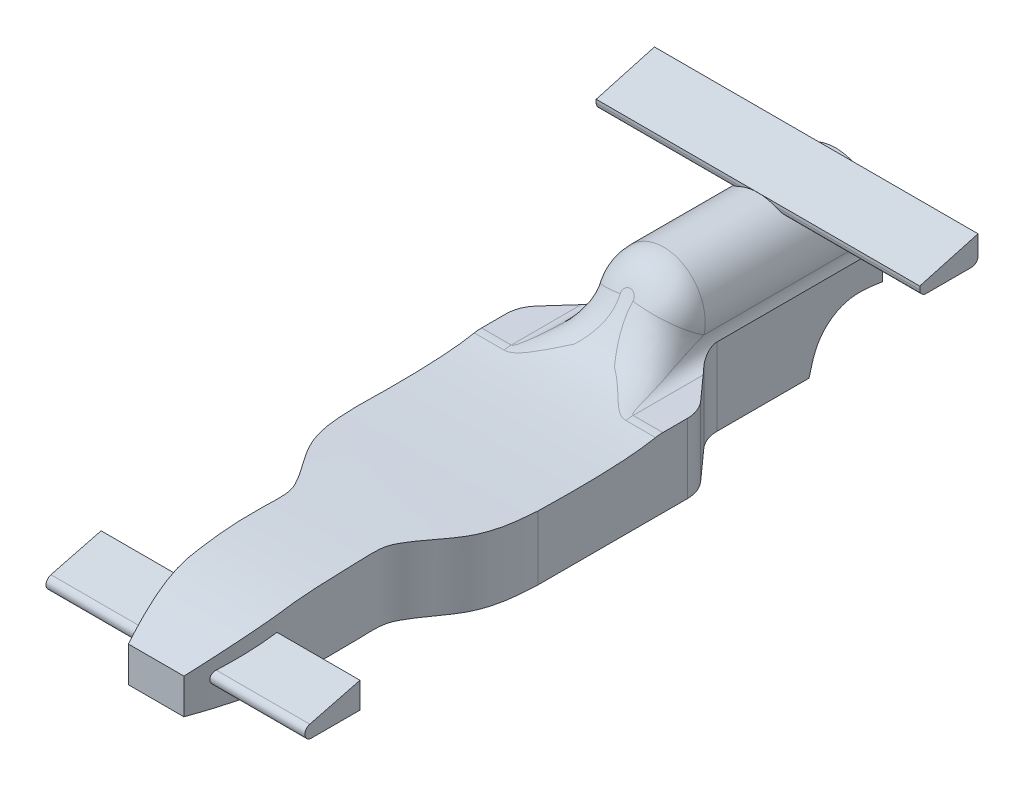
SolidWorks part; units mm, degrees
ref_plane "Front Plane" through (0, 0, 0) normal (0, 0, 1) x (1, 0, 0)
ref_plane "Top Plane" through (0, 0, 0) normal (0, 1, 0) x (1, 0, 0)
ref_plane "Right Plane" through (0, 0, 0) normal (1, 0, 0) x (0, 0, -1)
sketch "Sketch1" plane through (0, 0, 0) normal (0, 0, 1) x (1, 0, 0)
  line L1 (-32.5, 0) -> (32.5, 0)
  line L2 (-32.5, 0) -> (-32.5, 50)
  line L3 (-32.5, 50) -> (32.5, 50)
  line L4 (32.5, 0) -> (32.5, 50)
  dimension "D1" = 65
  dimension "D2" = 50
extrude "Balsa Block" add sketch "Sketch1" along normal blind 223
sketch "Sketch2" plane through (0, 0, 223) normal (0, 0, 1) x (1, 0, 0)
  line L0 (-32.5, 0) -> (32.5, 0) construction
  line L1 (-3, 0) -> (3, 0)
  line L2 (-3, 0) -> (-3, 6)
  line L3 (-3, 6) -> (3, 6)
  line L4 (3, 0) -> (3, 6)
  dimension "D1" = 6
  dimension "D2" = 6
extrude "Screw Eye Slot" [suppressed] cut sketch "Sketch2" against normal through all
sketch "Sketch3" plane through (0, 0, 0) normal (0, 0, -1) x (-1, 0, 0)
  line L0 (32.5, 0) -> (-32.5, 0) construction
  circle A0 centre (0, 29) radius 9.55
  dimension "D1" = 19.1
  dimension "D2" = 29
extrude "CO2 Cartridge Hole" cut sketch "Sketch3" against normal blind 52
sketch "Sketch5" plane through (0, 50, 0) normal (0, 1, 0) x (1, 0, 0)
  line L0 (32.5, 0) -> (-32.5, 0) construction
  line L1 (0, 0) -> (0, -229.7898) construction
  line L2 (-14.55, 0) -> (-14.55, -51.1732)
  line L3 (-17.1047, -57.8491) -> (-25.4453, -67.1509)
  line L4 (-28, -73.8268) -> (-28, -120)
  line L5 (-14.4879, 48.8908) -> (-14.4879, 49.7327) construction
  line L6 (28, -73.8268) -> (28, -120)
  line L7 (17.1047, -57.8491) -> (25.4453, -67.1509)
  line L8 (14.55, 0) -> (14.55, -51.1732)
  line L9 (-14.7766, 49.831) -> (-14.7766, 50.2789) construction
  line L10 (-9.55, 0) -> (-9.55, -52) construction
  line L11 (9.55, -52) -> (9.55, 0) construction
  arc A0 (-25.4453, -67.1509) -> (-28, -73.8268) centre (-18, -73.8268) ccw
  arc A1 (-14.55, -51.1732) -> (-17.1047, -57.8491) centre (-24.55, -51.1732) cw
  arc A2 (14.55, -51.1732) -> (17.1047, -57.8491) centre (24.55, -51.1732) ccw
  arc A3 (25.4453, -67.1509) -> (28, -73.8268) centre (18, -73.8268) cw
  spline S0 degree 3 poles (-28, -120) (-27.6859, -126.0056) (-27.1636, -135.9946) (-19.7034, -144.9636) (-13.3488, -154.8578) (-14.7766, -154.2092) (-14.7766, -173.3072) (-14.4879, -181.2754) (-14.4879, -195.7718) (-8.4397, -210.8954) (-2.3915, -226.019) knots 0 0 0 0 0.179945 0.299298 0.299298 0.625194 0.625194 0.690626 0.690626 1 1 1 1
  spline S1 degree 3 poles (28, -120) (27.6859, -126.0056) (27.1636, -135.9946) (19.7034, -144.9636) (13.3488, -154.8578) (14.7766, -154.2092) (14.7766, -173.3072) (14.4879, -181.2754) (14.4879, -195.7718) (8.4397, -210.8954) (2.3915, -226.019) knots 0 0 0 0 0.179945 0.299298 0.299298 0.625194 0.625194 0.690626 0.690626 1 1 1 1
  spline S2 degree 3 poles (-14.55, 0) (-14.55, -18.3333) (-14.55, -36.6667) (-14.55, -55) knots 0 0 0 0 1 1 1 1
  spline S3 degree 3 poles (14.55, 0) (14.55, -18.3333) (14.55, -36.6667) (14.55, -55) knots 0 0 0 0 1 1 1 1
  dimension "D2" = 5
  dimension "D1" = 5
sketch "Sketch6" plane through (0, 0, 0) normal (1, 0, 0) x (0, 0, -1)
  line L1 (-52, 19.45) -> (0, 19.45) construction
  line L3 (0, 10.39) -> (0, -10.39) construction
  line L10 (-210, 10.9116) -> (-210, 0)
  line L13 (-210, 0) -> (-22.7709, 0)
  spline S0 degree 3 poles (-210, 10.9116) (-202.7227, 13.8598) (-188.783, 19.5071) (-143.7313, 22.444) (-85.5632, 16.1988) (-63.4626, 33.1745) (-61.6089, 55.2214) (-24.8176, 48.2515) (0, 43.55) knots 0 0 0 0 0.060945 0.11674 0.333018 0.333018 0.550088 1 1 1 1
  spline S1 degree 3 poles (-22.7709, 0) (-21.942, 3.2613) (-20.3664, 9.4604) (-11.2641, 16.1435) (-4.1106, 15.068) (0, 14.45) knots 0 0 0 0 0.32075 0.609686 1 1 1 1
  dimension "D3" = 5
  dimension "D1" = 210
  dimension "D2" = 5
sketch "Sketch7" plane through (0, 0, 0) normal (0, 0, -1) x (-1, 0, 0)
  line L0 (18.8348, 21.5) -> (32.5, 21.5)
  line L2 (-18.8348, 21.5) -> (-32.5, 21.5)
  line L5 (0, 0) -> (0, 64.6236) construction
  arc A0 (13.8783, 27.1579) -> (-13.8783, 27.1579) centre (0, 29) ccw
  arc A1 (-13.8783, 27.1579) -> (-18.8348, 21.5) centre (-18.8348, 26.5) cw
  arc A2 (13.8783, 27.1579) -> (18.8348, 21.5) centre (18.8348, 26.5) ccw
  dimension "D1" = 14
  dimension "D3" = 5
  dimension "D2" = 21.5
  dimension "D4" = 65
sketch "Sketch8" plane through (0, 0, 0) normal (1, 0, 0) x (0, 0, -1)
  line L0 (-202.5076, 10) -> (-187, 14)
  line L1 (-187, 14) -> (-187, 6)
  line L2 (-187, 6) -> (-202, 6)
  line L3 (-210, 0) -> (-22.7709, 0) construction
  line L6 (-210, 10.9116) -> (-210, 0) construction
  arc A0 (-202.5076, 10) -> (-202, 6) centre (-202, 8.0322) ccw
  dimension "D1" = 15
  dimension "D2" = 6
  dimension "D3" = 8
  dimension "D4" = 10
  dimension "D5" = 8
extrude "Cut-Extrude1" cut sketch "Sketch5" against normal through all contours S0 L4 A0 L3 A1 L2 M33 M34 M35 | L6 S1 L8 A2 L7 A3 M35 M36 M33
extrude "Cut-Extrude2" cut sketch "Sketch6" against normal through all and the other way through all flip side to cut
extrude "Cut-Extrude3" cut sketch "Sketch7" against normal through all and the other way through all flip side to cut
extrude "Boss-Extrude1" add sketch "Sketch8" along normal mid plane 80
sketch "Sketch9" plane through (0, 0, 0) normal (1, 0, 0) x (0, 0, -1)
  line L0 (-24, 43) -> (-6, 48)
  line L1 (0, 43) -> (-59.8515, 43) construction
  line L2 (-6, 48) -> (-6, 42)
  line L3 (-8, 40) -> (-22, 40)
  line L4 (-24, 42) -> (-24, 43)
  line L5 (0, 27.1579) -> (0, 43) construction
  arc A0 (-6, 42) -> (-8, 40) centre (-8, 42) cw
  arc A1 (-22, 40) -> (-24, 42) centre (-22, 42) cw
  dimension "D1" = 2
  dimension "D2" = 3
  dimension "D3" = 8
  dimension "D4" = 18
  dimension "D5" = 6
extrude "Boss-Extrude2" add sketch "Sketch9" along normal mid plane 100
fillet "Fillet1" [suppressed] radius 3
sketch "Sketch10" plane through (0, 0, 0) normal (0, 0, -1) x (-1, 0, 0)
  circle A0 centre (0, 29) radius 9.55 construction
  circle A1 centre (0, 29) radius 9.55
extrude "Boss-Extrude3" add sketch "Sketch10" against normal up to body
fillet "Fillet2" radius 12 5 edges at (23.4174, 21.5, 82.6025) (17.1807, 21.7815, 81.3793) (-23.4174, 21.5, 82.6025) (-17.3362, 21.7299, 81.5913) (0.0541, 42.9999, 59.8516)
scale "Scale1" scale about centroid uniform scaling yes scale factor 0.1
